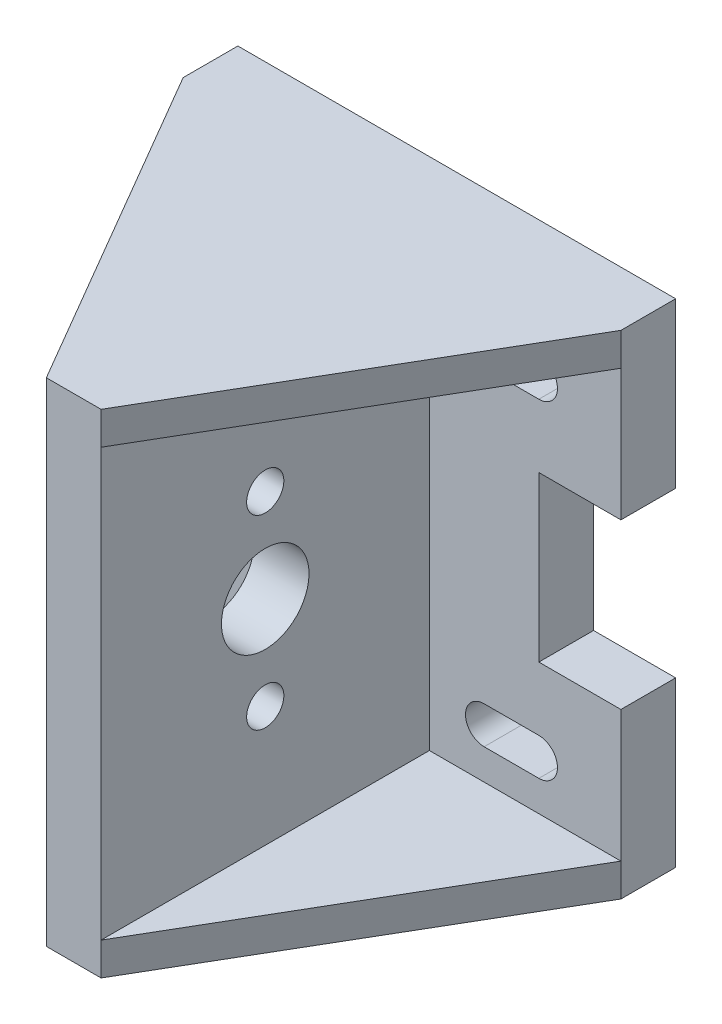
SolidWorks part; units mm, degrees
ref_plane "前视基准面" through (0, 0, 0) normal (0, 0, 1) x (1, 0, 0)
ref_plane "上视基准面" through (0, 0, 0) normal (0, 1, 0) x (1, 0, 0)
ref_plane "右视基准面" through (0, 0, 0) normal (1, 0, 0) x (0, 0, -1)
sketch "草图1" plane through (0, 0, 0) normal (0, 0, 1) x (1, 0, 0)
  line L1 (-20, 22.5) -> (20, 22.5)
  line L2 (-20, 22.5) -> (-20, -22.5)
  line L3 (-20, -22.5) -> (20, -22.5)
  line L4 (20, 22.5) -> (20, -22.5)
  line L5 (-20, 22.5) -> (20, -22.5) construction
  line L6 (-20, -22.5) -> (20, 22.5) construction
  point P0 (0, 0)
  dimension "D1" = 45
  dimension "D2" = 40
extrude "凸台-拉伸1" add sketch "草图1" along normal blind 5
sketch "草图2" plane through (0, 0, 5) normal (0, 0, 1) x (1, 0, 0)
  line L0 (-20, -22.5) -> (20, -22.5) construction
  line L1 (-2.5, 22.5) -> (2.5, 22.5)
  line L2 (-2.5, 22.5) -> (-2.5, -22.5)
  line L3 (-2.5, -22.5) -> (2.5, -22.5)
  line L4 (2.5, 22.5) -> (2.5, -22.5)
  dimension "D1" = 5
  dimension "D2" = 2.5
extrude "凸台-拉伸2" add sketch "草图2" along normal blind 30
sketch "草图3" plane through (0, 22.5, 0) normal (0, 1, 0) x (1, 0, 0)
  line L0 (2.5, -35) -> (2.5, -5)
  line L1 (2.5, -5) -> (20, -5)
  line L2 (20, -5) -> (2.5, -35)
extrude "凸台-拉伸3" [suppressed] add sketch "草图3" against normal blind 3
ref_plane "基准面1" through (0, 0, 0) normal (0, 1, 0) x (1, 0, 0)
mirror "镜向1" [suppressed] about plane through (0, 0, 0) normal (0, 1, 0)
sketch "草图4" plane through (2.5, 0, 0) normal (1, 0, 0) x (0, 0, -1)
  line L0 (-5, -22.5) -> (-5, 22.5) construction
  circle A0 centre (-20, 0) radius 4
  dimension "D1" = 8
  dimension "D2" = 15
extrude "切除-拉伸1" cut sketch "草图4" against normal through all
hole_wizard "Ø3.4 (3.4) 直径孔1" positions "草图5" profile "草图6" hole size "Ø3.4" standard "GB"
sketch "草图5" plane through (-20, 0, 0) normal (-1, 0, 0) x (0, 0, 1)
  circle A0 centre (20, 0) radius 4 construction
  point P0 (20, -8.5)
  point P2 (20, 8.5)
  dimension "D1" = 17
  dimension "D2" = 8.5
  dimension "D3" = 20
  dimension "D4" = 20
sketch "草图6" plane through (-20, -8.5, 20) normal (0, 1, 0) x (0, 0, 1)
  line L0 (0, 0) -> (0, 40)
  line L1 (0, 40) -> (1.7, 40)
  line L2 (1.7, 40) -> (1.7, 0)
  line L5 (1.7, 0) -> (0, 0)
  line L11 (0, -6.35) -> (0, 107.95) construction
  dimension "通孔孔直径" = 3.4
  dimension "通孔孔深度" = 40
hole_wizard "Ø3.4 (3.4) 直径孔2" positions "草图7" profile "草图8" hole size "Ø3.4" standard "GB"
sketch "草图7" plane through (0, 0, 5) normal (0, 0, 1) x (1, 0, 0)
  point P0 (10, 15)
  point P2 (-10, 15)
  point P4 (10, -15)
  point P6 (-10, -15)
  dimension "D1" = 30
  dimension "D2" = 30
  dimension "D3" = 15
  dimension "D4" = 15
  dimension "D5" = 20
  dimension "D6" = 10
sketch "草图8" plane through (10, 15, 5) normal (1, 0, 0) x (0, -1, 0)
  line L0 (0, 0) -> (0, 5)
  line L1 (0, 5) -> (1.7, 5)
  line L2 (1.7, 5) -> (1.7, 0)
  line L5 (1.7, 0) -> (0, 0)
  line L11 (0, -6.35) -> (0, 107.95) construction
  dimension "通孔孔直径" = 3.4
  dimension "通孔孔深度" = 5
sketch "草图9" plane through (0, 22.5, 0) normal (0, 1, 0) x (1, 0, 0)
  line L0 (-20, -5) -> (-2.5, -5)
  line L1 (-2.5, -5) -> (-2.5, -35)
  line L2 (-2.5, -35) -> (-20, -5)
  line L3 (2.5, -5) -> (2.5, -35)
  line L4 (2.5, -35) -> (20, -5)
  line L5 (20, -5) -> (2.5, -5)
extrude "凸台-拉伸4" add sketch "草图9" against normal blind 3
ref_plane "基准面2" through (0, 0, 0) normal (0, 1, 0) x (1, 0, 0)
mirror "镜向2" about plane through (0, 0, 0) normal (0, 1, 0) of "凸台-拉伸4"
sketch "草图10" plane through (0, 0, 5) normal (0, 0, 1) x (1, 0, 0)
  line L0 (-20, 19.5) -> (-20, -19.5) construction
  line L1 (-27.5, 7.5) -> (-12.5, 7.5)
  line L2 (-27.5, 7.5) -> (-27.5, -7.5)
  line L3 (-27.5, -7.5) -> (-12.5, -7.5)
  line L4 (-12.5, 7.5) -> (-12.5, -7.5)
  line L5 (-27.5, 7.5) -> (-12.5, -7.5) construction
  line L6 (-27.5, -7.5) -> (-12.5, 7.5) construction
  line L7 (-2.5, 19.5) -> (-2.5, -19.5) construction
  point P0 (-20, 0)
  dimension "D1" = 15
  dimension "D2" = 10
extrude "切除-拉伸2" cut sketch "草图10" against normal through all
sketch "草图11" plane through (0, 0, 5) normal (0, 0, 1) x (1, 0, 0)
  line L0 (-12.5, 15) -> (-7.5, 15) construction
  line L1 (-12.5, 16.7) -> (-7.5, 16.7)
  line L2 (-12.5, 13.3) -> (-7.5, 13.3)
  line L3 (7.5, 15) -> (12.5, 15) construction
  line L4 (7.5, 16.7) -> (12.5, 16.7)
  line L5 (7.5, 13.3) -> (12.5, 13.3)
  line L6 (-12.5, -15) -> (-7.5, -15) construction
  line L7 (-12.5, -13.3) -> (-7.5, -13.3)
  line L8 (-12.5, -16.7) -> (-7.5, -16.7)
  line L9 (7.5, -15) -> (12.5, -15) construction
  line L10 (7.5, -13.3) -> (12.5, -13.3)
  line L11 (7.5, -16.7) -> (12.5, -16.7)
  arc A1 (-12.5, 16.7) -> (-12.5, 13.3) centre (-12.5, 15) ccw
  arc A2 (-7.5, 13.3) -> (-7.5, 16.7) centre (-7.5, 15) ccw
  arc A4 (7.5, 16.7) -> (7.5, 13.3) centre (7.5, 15) ccw
  arc A5 (12.5, 13.3) -> (12.5, 16.7) centre (12.5, 15) ccw
  arc A8 (-12.5, -13.3) -> (-12.5, -16.7) centre (-12.5, -15) ccw
  arc A9 (-7.5, -16.7) -> (-7.5, -13.3) centre (-7.5, -15) ccw
  arc A11 (7.5, -13.3) -> (7.5, -16.7) centre (7.5, -15) ccw
  arc A12 (12.5, -16.7) -> (12.5, -13.3) centre (12.5, -15) ccw
  point P2 (10, 15)
  point P5 (-10, 15)
  point P16 (-10, -15)
  point P23 (10, -15)
  point P32 (-10, -15)
  point P33 (10, -15)
  point P34 (10, 15)
  dimension "D1" = 1.7
  dimension "D2" = 1.7
  dimension "D3" = 1.7
  dimension "D4" = 1.7
  dimension "D5" = 5
  dimension "D6" = 5
  dimension "D7" = 5
  dimension "D8" = 5
extrude "切除-拉伸3" cut sketch "草图11" against normal through all
mirror "镜向3" about plane through (0, 0, 0) normal (1, 0, 0) of "切除-拉伸2"
